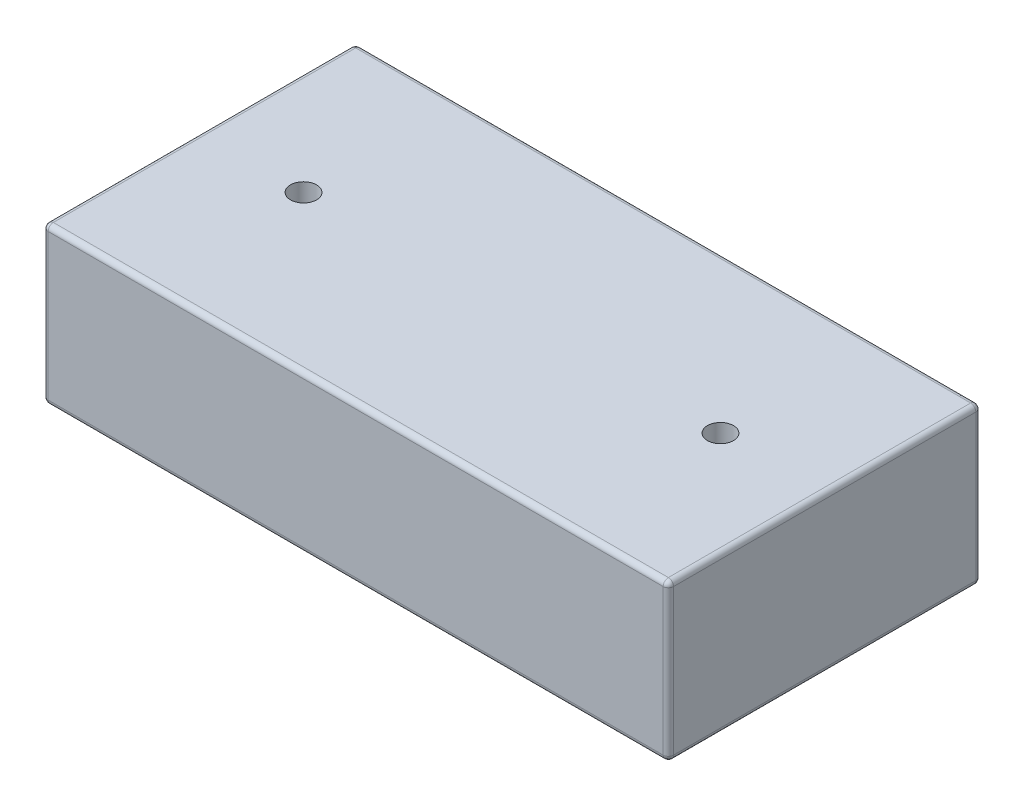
SolidWorks part; units mm, degrees
ref_plane "Front Plane" through (0, 0, 0) normal (0, 0, 1) x (1, 0, 0)
ref_plane "Top Plane" through (0, 0, 0) normal (0, 1, 0) x (1, 0, 0)
ref_plane "Right Plane" through (0, 0, 0) normal (1, 0, 0) x (0, 0, -1)
sketch "Sketch1" plane through (0, 0, 0) normal (0, 1, 0) x (1, 0, 0)
  line L1 (304.8, 152.4) -> (-304.8, 152.4)
  line L2 (304.8, 152.4) -> (304.8, -152.4)
  line L3 (304.8, -152.4) -> (-304.8, -152.4)
  line L4 (-304.8, 152.4) -> (-304.8, -152.4)
  dimension "D1" = 609.6
  dimension "D2" = 304.8
  dimension "D3" = 152.4
  dimension "D4" = 304.8
extrude "Extrude1" add sketch "Sketch1" along normal mid plane 152.4
sketch "Sketch2" plane through (0, 76.2, 0) normal (0, 1, 0) x (-1, 0, 0)
  circle A0 centre (203.2, 0) radius 12.7
  circle A1 centre (-203.2, 0) radius 12.7
  dimension "D1" = 25.4
  dimension "D2" = 203.2
  dimension "D3" = 203.2
extrude "Cut-Extrude1" cut sketch "Sketch2" against normal through all
fillet "Fillet1" radius 5.08 4 edges at (304.8, 76.2, 0) (0, 76.2, 152.4) (0, 76.2, -152.4) (-304.8, 76.2, 0)
fillet "Fillet2" radius 5.08 4 edges at (-304.8, -76.2, 0) (0, -76.2, 152.4) (304.8, -76.2, 0) (0, -76.2, -152.4)
fillet "Fillet3" radius 5.08 3 edges at (-303.3121, 74.7121, -150.9121) (-303.3121, -74.7121, -150.9121) (-304.8, 0, -152.4)
fillet "Fillet4" radius 5.08 3 edges at (-303.3121, 74.7121, 150.9121) (-303.3121, -74.7121, 150.9121) (-304.8, 0, 152.4)
fillet "Fillet5" radius 5.08 6 edges at (303.3121, 74.7121, -150.9121) (303.3121, -74.7121, -150.9121) (303.3121, 74.7121, 150.9121) (303.3121, -74.7121, 150.9121) (304.8, 0, -152.4) (304.8, 0, 152.4)
